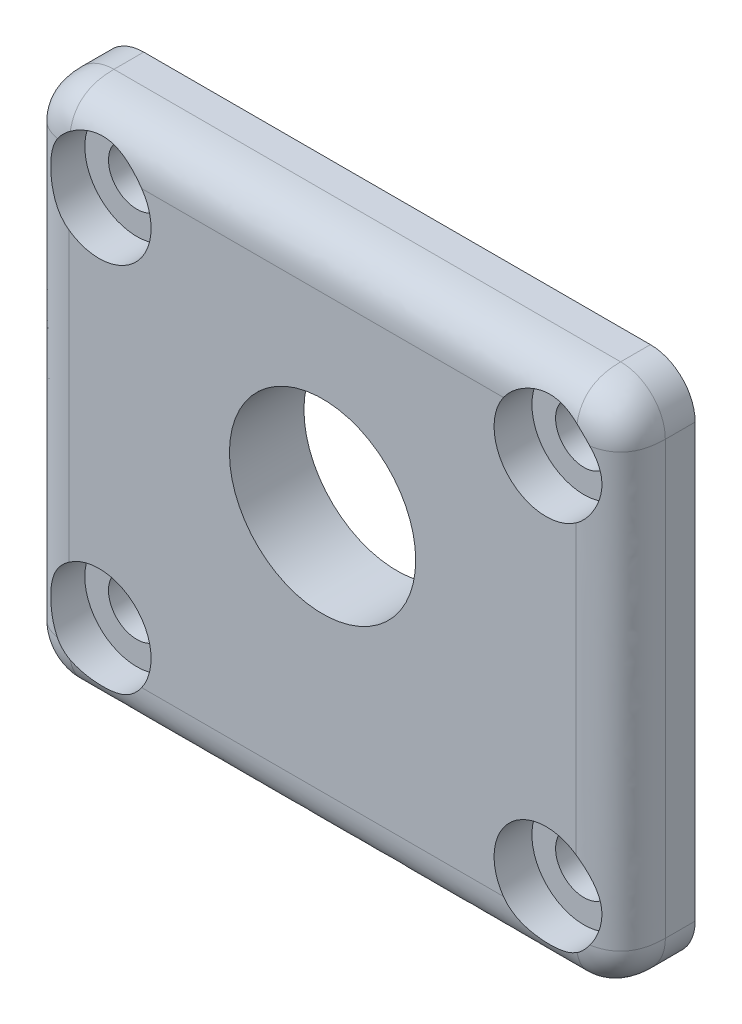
SolidWorks part; units mm, degrees
ref_plane "Front Plane" through (0, 0, 0) normal (0, 0, 1) x (1, 0, 0)
ref_plane "Top Plane" through (0, 0, 0) normal (0, 1, 0) x (1, 0, 0)
ref_plane "Right Plane" through (0, 0, 0) normal (1, 0, 0) x (0, 0, -1)
sketch "Sketch1" plane through (0, 0, 0) normal (0, 0, 1) x (1, 0, 0)
  line L1 (-20, 17.5) -> (20, 17.5)
  line L2 (-20, 17.5) -> (-20, -17.5)
  line L3 (-20, -17.5) -> (20, -17.5)
  line L4 (20, 17.5) -> (20, -17.5)
  line L5 (-20, 17.5) -> (20, -17.5) construction
  line L6 (-20, -17.5) -> (20, 17.5) construction
  point P0 (0, 0)
  dimension "D1" = 40
  dimension "D2" = 35
extrude "Boss-Extrude1" add sketch "Sketch1" along normal blind 5
sketch "Sketch2" plane through (0, 0, 5) normal (0, 0, 1) x (1, 0, 0)
  line L0 (20, 17.5) -> (-20, 17.5) construction
  line L1 (-20, 17.5) -> (-20, -17.5) construction
  line L2 (0, 17.5) -> (0, -17.5) construction
  line L3 (-20, -17.5) -> (20, -17.5) construction
  line L4 (20, 0) -> (-20, 0) construction
  line L5 (20, -17.5) -> (20, 17.5) construction
  circle A0 centre (-15, 12.5) radius 1.905
  circle A1 centre (15, 12.5) radius 1.905
  circle A2 centre (15, -12.5) radius 1.905
  circle A3 centre (-15, -12.5) radius 1.905
  dimension "D1" = 3.81
  dimension "D2" = 5
  dimension "D3" = 5
extrude "Cut-Extrude1" cut sketch "Sketch2" against normal through all
fillet "Fillet1" radius 3 4 edges at (20, 17.5, 2.5) (20, -17.5, 2.5) (-20, -17.5, 2.5) (-20, 17.5, 2.5)
sketch "Sketch3" plane through (0, 0, 5) normal (0, 0, 1) x (1, 0, 0)
  line L0 (0, 17.5) -> (0, -17.5) construction
  line L1 (17, 17.5) -> (-17, 17.5) construction
  line L2 (-17, -17.5) -> (17, -17.5) construction
  line L3 (-20, 0) -> (20, 0) construction
  line L4 (-20, 14.5) -> (-20, -14.5) construction
  line L5 (20, -14.5) -> (20, 14.5) construction
  circle A0 centre (-15, 12.5) radius 3.4925
  circle A1 centre (15, 12.5) radius 3.4925
  circle A2 centre (15, -12.5) radius 3.4925
  circle A3 centre (-15, -12.5) radius 3.4925
  dimension "D1" = 6.985
extrude "Cut-Extrude2" cut sketch "Sketch3" against normal blind 2.54
fillet "Fillet2" radius 3 4 edges at (20, 0, 5) (0, 17.5, 5) (0, -17.5, 5) (-20, 0, 5)
sketch "Sketch5" plane through (0, 0, 0) normal (0, 0, -1) x (-1, 0, 0)
  line L0 (0, 17.5) -> (0, -17.5) construction
  line L1 (-17, 17.5) -> (17, 17.5) construction
  line L2 (17, -17.5) -> (-17, -17.5) construction
  line L3 (-20, 0) -> (20, 0) construction
  line L4 (-20, -14.5) -> (-20, 14.5) construction
  line L5 (20, 14.5) -> (20, -14.5) construction
  line L6 (-9.601, -11) -> (9.601, -11)
  line L7 (13.5, 7.101) -> (13.5, -7.101)
  line L8 (13.5, 0) -> (13.5, -17.5) construction
  line L9 (-9.601, 11) -> (9.601, 11)
  line L10 (-13.5, 7.101) -> (-13.5, -7.101)
  line L11 (-10.5, 12) -> (10.5, 12)
  line L12 (14.5, 8) -> (14.5, -8)
  line L13 (-10.5, -12) -> (10.5, -12)
  line L14 (-14.5, 8) -> (-14.5, -8)
  arc A0 (13.5, -7.101) -> (9.601, -11) centre (14.5, -12) ccw
  arc A1 (13.5, 7.101) -> (9.601, 11) centre (14.5, 12) cw
  arc A2 (-13.5, -7.101) -> (-9.601, -11) centre (-14.5, -12) cw
  arc A3 (-13.5, 7.101) -> (-9.601, 11) centre (-14.5, 12) ccw
  arc A4 (14.5, 8) -> (10.5, 12) centre (14.5, 12) cw
  arc A5 (14.5, -8) -> (10.5, -12) centre (14.5, -12) ccw
  arc A6 (-14.5, -8) -> (-10.5, -12) centre (-14.5, -12) cw
  arc A7 (-14.5, 8) -> (-10.5, 12) centre (-14.5, 12) ccw
  arc A8 (13.5, -7.101) -> (9.601, -11) centre (14.5, -12) ccw construction
  point P24 (0, -11)
  point P29 (0, 11)
  dimension "D3" = 5.5
  dimension "D4" = 5
  dimension "D1" = 6.5
  dimension "D2" = 6.5
extrude "Boss-Extrude2" add sketch "Sketch5" along normal blind 2.5
sketch "Sketch6" plane through (0, 0, 0) normal (0, 0, -1) x (-1, 0, 0)
  line L5 (-13.25, -8) -> (13.25, -8)
  line L10 (13.25, -8) -> (13.25, -6)
  line L11 (-13.25, -6) -> (13.25, -6)
  line L13 (-13.25, -8) -> (-13.25, -6)
  line L14 (17, -17.5) -> (-17, -17.5) construction
  line L15 (0, 17.5) -> (0, -17.5) construction
  line L16 (-17, 17.5) -> (17, 17.5) construction
  point P9 (0, -6)
  dimension "D1" = 2
  dimension "D2" = 9.5
  dimension "D3" = 26.5
extrude "Cut-Extrude4" cut sketch "Sketch6" along normal up to next
sketch "Sketch7" plane through (0, 0, 5) normal (0, 0, 1) x (1, 0, 0)
  line L0 (17, -17.5) -> (-17, -17.5) construction
  circle A0 centre (0, 2.1) radius 6.25
  dimension "D2" = 12.5
  dimension "D1" = 19.6
extrude "Cut-Extrude3" cut sketch "Sketch7" against normal up to next
sketch "Sketch8" plane through (0, 0, 0) normal (0, 0, -1) x (-1, 0, 0)
  line L0 (-14.5, -8) -> (14.5, -8)
  line L8 (10.5, -12) -> (-10.5, -12)
  line L9 (10.5, -12) -> (-10.5, -12)
  arc A12 (14.5, -8) -> (10.5, -12) centre (14.5, -12) ccw
  arc A13 (-10.5, -12) -> (-14.5, -8) centre (-14.5, -12) ccw
  arc A14 (14.5, -8) -> (10.5, -12) centre (14.5, -12) ccw
  arc A15 (-10.5, -12) -> (-14.5, -8) centre (-14.5, -12) ccw
  dimension "D1" = 0
extrude "Boss-Extrude4" add sketch "Sketch8" along normal up to surface (2.5 mm away)
